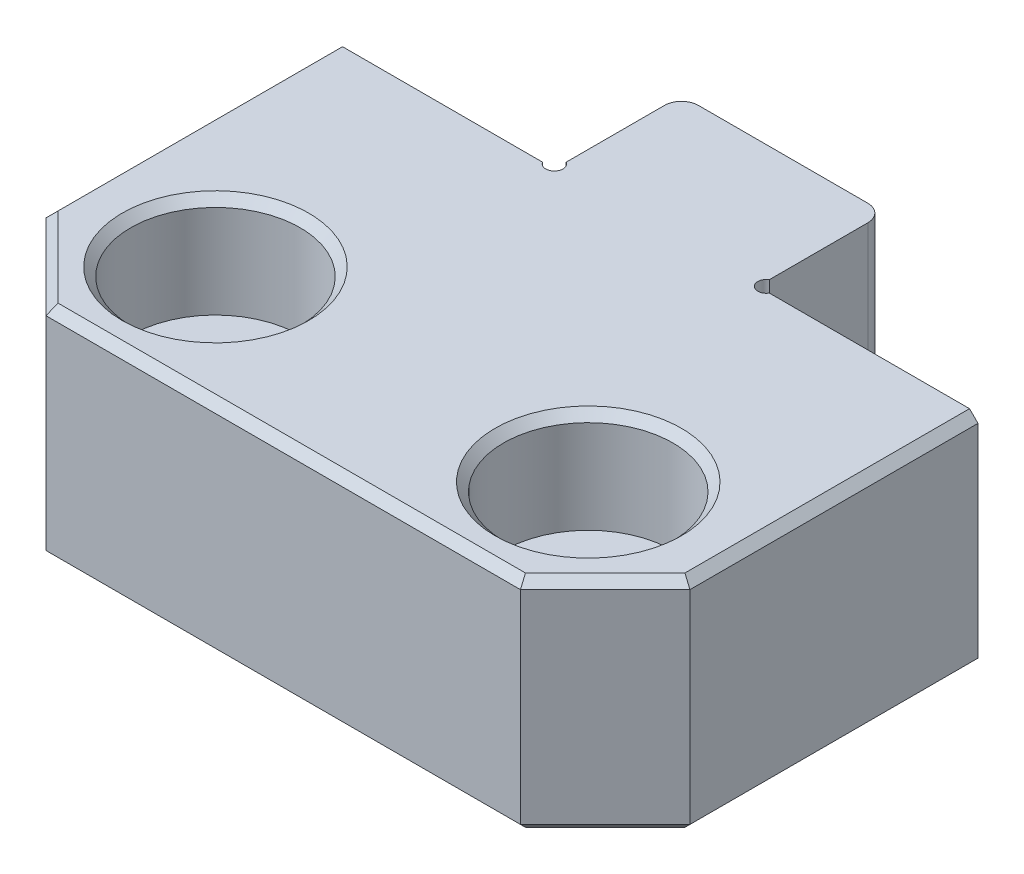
SolidWorks part; units mm, degrees
ref_plane "Front Plane" through (0, 0, 0) normal (0, 0, 1) x (1, 0, 0)
ref_plane "Top Plane" through (0, 0, 0) normal (0, 1, 0) x (1, 0, 0)
ref_plane "Right Plane" through (0, 0, 0) normal (1, 0, 0) x (0, 0, -1)
sketch "Sketch2" plane through (0, 0, 0) normal (0, 1, 0) x (1, 0, 0)
  line L0 (-6, 0.6939) -> (-6, 7.5)
  line L1 (-19, -22) -> (19, -22)
  line L2 (-19, -22) -> (-19, 0)
  line L3 (-19, 0) -> (-6.6939, 0)
  line L4 (19, -22) -> (19, 0)
  line L5 (-6, 7.5) -> (6, 7.5)
  line L6 (6, 7.5) -> (6, 0.6847)
  line L7 (6.6847, 0) -> (19, 0)
  line L8 (0, -55) -> (0, 55) construction
  line L9 (-55, 0) -> (55, 0) construction
  arc A0 (6, 0.6847) -> (6.6847, 0) centre (6.254, 0.254) ccw
  circle A1 centre (-11, -15) radius 2.9
  arc A2 (-6.6939, 0) -> (-6, 0.6939) centre (-6.254, 0.254) ccw
  circle A3 centre (11, -15) radius 2.9
  dimension "D8" = 0.254
  dimension "D9" = 8
  dimension "D12" = 1.016
  dimension "D13" = 0.254
  dimension "D14" = 1
  dimension "D15" = 5.8
  dimension "D16" = 7
  dimension "D18" = 5.8
  dimension "D1" = 38
  dimension "D2" = 7
  dimension "D3" = 19
  dimension "D4" = 22
  dimension "D5" = 7.5
  dimension "D6" = 6
  dimension "D7" = 12
  dimension "D10" = 0.254
  dimension "D11" = 0.254
  dimension "D17" = 8
extrude "Extrude1" add sketch "Sketch2" against normal blind 13
fillet "Fillet1" radius 1 2 edges at (-6, -6.5, -7.5) (6, -6.5, -7.5)
chamfer "Chamfer1" distance 5 angle 45 2 edges at (19, -6.5, 22) (-19, -6.5, 22)
sketch "Sketch3" plane through (0, 0, 0) normal (0, 1, 0) x (1, 0, 0)
  circle A1 centre (-11, -15) radius 5
  dimension "D1" = 10
extrude "Cut-Extrude1" cut sketch "Sketch3" against normal blind 6
mirror "Mirror1" about plane through (0, 0, 0) normal (1, 0, 0) of "Cut-Extrude1"
chamfer "Chamfer2" distance 0.5 angle 45 10 edges at (19, -13, 8.5) (19, 0, 8.5) (16.5, 0, 19.5) (0, 0, 22) (-16.5, 0, 19.5) (-19, 0, 8.5) (-19, -13, 8.5) (-16.5, -13, 19.5) (0, -13, 22) (16.5, -13, 19.5)
chamfer "Chamfer3" distance 0.5 angle 45 2 edges at (-11, 0, 20) (11, 0, 20)
sketch "Sketch4" plane through (0, -13, 0) normal (0, -1, 0) x (1, 0, 0)
  line L0 (7.15, 0) -> (-7.15, 0) construction
  line L1 (-16.2341, -18.9246) -> (13.4555, -18.9246)
  line L2 (-16.2341, -18.9246) -> (-16.2341, 0)
  line L3 (-16.2341, 0) -> (13.4555, 0)
  line L4 (13.4555, -18.9246) -> (13.4555, 0)
extrude "Cut-Extrude2" cut sketch "Sketch4" against normal blind 0.5
